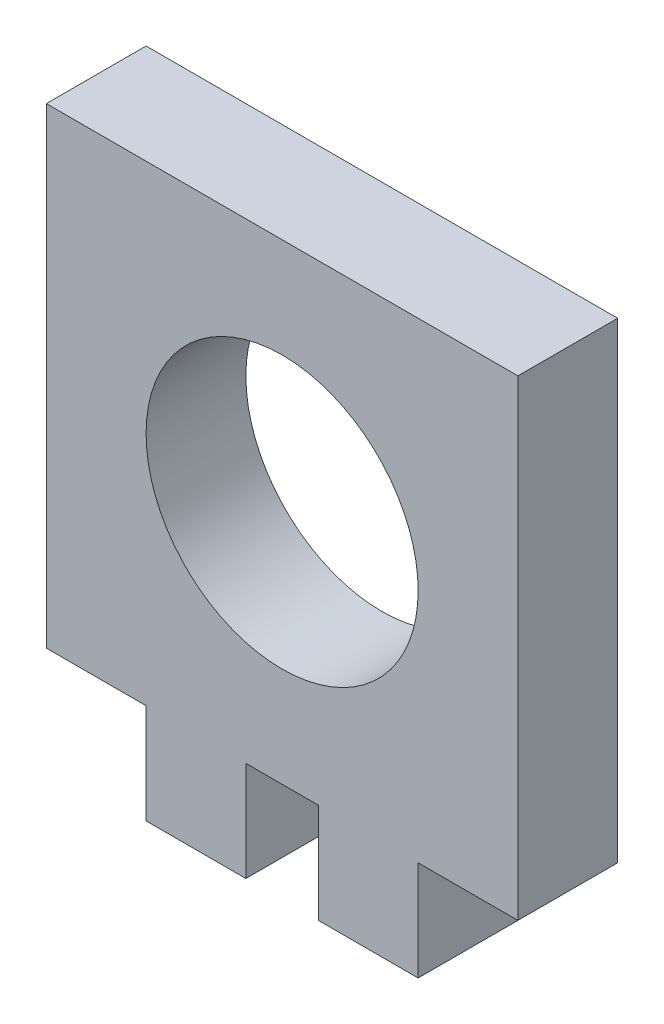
SolidWorks part; units mm, degrees
ref_plane "Front Plane" through (0, 0, 0) normal (0, 0, 1) x (1, 0, 0)
ref_plane "Top Plane" through (0, 0, 0) normal (0, 1, 0) x (1, 0, 0)
ref_plane "Right Plane" through (0, 0, 0) normal (1, 0, 0) x (0, 0, -1)
sketch "Sketch1" plane through (0, 0, 0) normal (0, 0, 1) x (1, 0, 0)
  line L0 (0, 0) -> (-26, 0) construction
  line L1 (-26, 0) -> (-26, 5.5) construction
  line L2 (-26, 5.5) -> (0, 5.5) construction
  line L3 (0, 5.5) -> (0, 0) construction
  line L4 (-13, 5.5) -> (-13, 18.5) construction
  line L5 (-26, 5.5) -> (-26, 31.5) construction
  line L6 (-26, 31.5) -> (0, 31.5) construction
  line L7 (0, 31.5) -> (0, 5.5) construction
  line L8 (0, 5.5) -> (-5.5, 5.5) construction
  line L9 (-26, 5.5) -> (-20.5, 5.5) construction
  line L10 (-20.5, 5.5) -> (-15, 5.5) construction
  line L11 (-5.5, 5.5) -> (-11, 5.5) construction
  line L12 (-20.5, 5.5) -> (-20.5, 31.5) construction
  line L13 (-20.5, 31.5) -> (-20.5, 26) construction
  line L14 (-20.5, 26) -> (-5.5, 26) construction
  line L15 (-5.5, 5.5) -> (-5.5, 31.5) construction
  line L16 (-20.5, 5.5) -> (-20.5, 0) construction
  line L17 (-20.5, 0) -> (-15, 0) construction
  line L18 (-15, 0) -> (-15, 5.5) construction
  line L19 (-11, 5.5) -> (-11, 0) construction
  line L20 (-11, 0) -> (-5.5, 0) construction
  line L21 (-5.5, 0) -> (-5.5, 5.5) construction
  line L22 (-26, 31.5) -> (-26, 5.5)
  line L23 (-26, 5.5) -> (-20.5, 5.5)
  line L24 (-20.5, 5.5) -> (-20.5, 0)
  line L25 (-20.5, 0) -> (-15, 0)
  line L26 (-15, 0) -> (-15, 5.5)
  line L27 (-15, 5.5) -> (-11, 5.5)
  line L28 (-11, 5.5) -> (-11, 0)
  line L29 (-11, 0) -> (-5.5, 0)
  line L30 (-5.5, 0) -> (-5.5, 5.5)
  line L31 (-5.5, 5.5) -> (0, 5.5)
  line L32 (0, 5.5) -> (0, 31.5)
  line L33 (0, 31.5) -> (-26, 31.5)
  circle A0 centre (-13, 18.5) radius 7.5
  dimension "D1" = 26
  dimension "D2" = 15
  dimension "D3" = 5.5
extrude "Boss-Extrude1" add sketch "Sketch1" along normal blind 5.5
